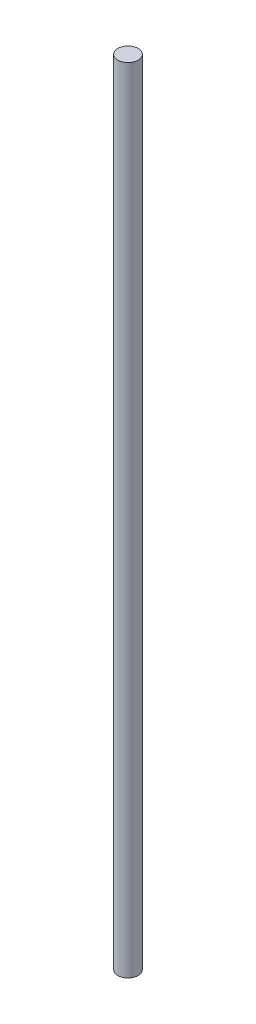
SolidWorks part; units mm, degrees
ref_plane "Front Plane" through (0, 0, 0) normal (0, 0, 1) x (1, 0, 0)
ref_plane "Top Plane" through (0, 0, 0) normal (0, 1, 0) x (1, 0, 0)
ref_plane "Right Plane" through (0, 0, 0) normal (1, 0, 0) x (0, 0, -1)
sketch "Sketch1" plane through (0, 0, 0) normal (0, 0, 1) x (1, 0, 0)
  line L0 (0, 0) -> (0, 247.65) construction
  line L1 (0, 247.65) -> (3.175, 247.65)
  line L2 (3.175, 247.65) -> (3.175, 0)
  line L3 (3.175, 0) -> (0, 0)
  line L4 (0, 0) -> (0, 247.65)
  dimension "D1" = 247.65
  dimension "D2" = 6.35
revolve "Revolve1" add sketch "Sketch1" angle 360 about L0
